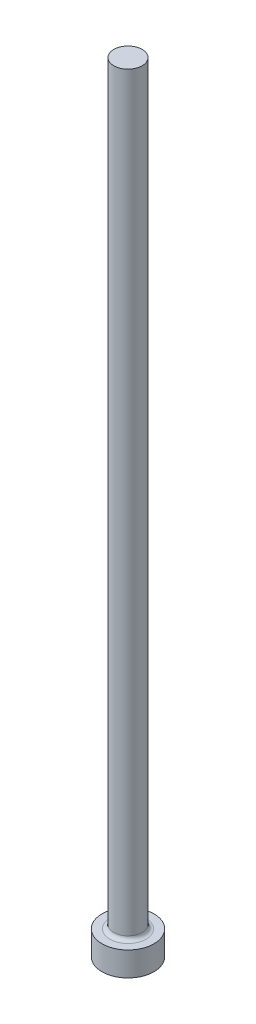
SolidWorks part; units mm, degrees
ref_plane "Front Plane" through (0, 0, 0) normal (0, 0, 1) x (1, 0, 0)
ref_plane "Top Plane" through (0, 0, 0) normal (0, 1, 0) x (1, 0, 0)
ref_plane "Right Plane" through (0, 0, 0) normal (1, 0, 0) x (0, 0, -1)
sketch "Sketch1" plane through (0, 0, 0) normal (0, 0, 1) x (1, 0, 0)
  line L0 (0, 0) -> (5.08, 0)
  line L1 (55, 0) -> (-55, 0) construction
  line L2 (5.08, 0) -> (5.08, 4.7498)
  line L3 (5.08, 4.7498) -> (3.5395, 4.7498)
  line L4 (2.7775, 5.5118) -> (2.7775, 152.4)
  line L5 (2.7775, 152.4) -> (0, 152.4)
  line L6 (0, 152.4) -> (0, 0)
  arc A0 (3.5395, 4.7498) -> (2.7775, 5.5118) centre (3.5395, 5.5118) cw
  dimension "D5" = 0.762
  dimension "D1" = 2.7775
  dimension "D2" = 5.08
  dimension "D3" = 4.7498
  dimension "D4" = 152.4
revolve "Revolve1" add sketch "Sketch1" angle 360 about L6
